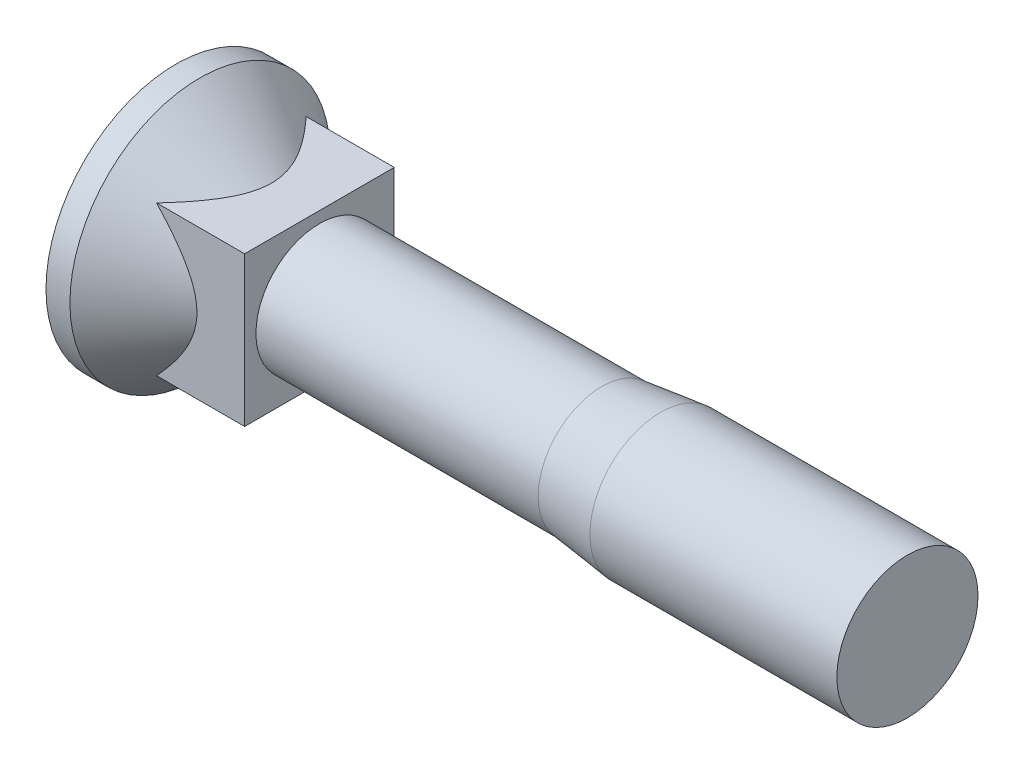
SolidWorks part; units mm, degrees
ref_plane "Front" through (0, 0, 0) normal (0, 0, 1) x (1, 0, 0)
ref_plane "Top" through (0, 0, 0) normal (0, 1, 0) x (1, 0, 0)
ref_plane "Right" through (0, 0, 0) normal (1, 0, 0) x (0, 0, -1)
other "Configuration Table"
ref_plane "Plane1" through (6.1, 0, 0) normal (1, 0, 0) x (0, 0, -1)
sketch "Sketch1" plane through (0, 0, 0) normal (0, 0, 1) x (1, 0, 0)
  line L0 (-5.3098, 0) -> (7.9048, 0) construction
  line L1 (0, 5.525) -> (0, 0)
  line L2 (0, 5.525) -> (1.0167, 5.525)
  line L3 (1.0167, 5.525) -> (7.5545, 0.5083)
  line L4 (7.5545, 0.5083) -> (7.5545, 0)
  line L5 (0, 0) -> (7.5545, 0)
revolve "BaseHead" add sketch "Sketch1" angle 360 about L0
sketch "Sketch2" plane through (6.1, 0, 0) normal (1, 0, 0) x (0, 0, -1)
  line L1 (3.18, -3.18) -> (3.18, 3.18)
  line L2 (3.18, 3.18) -> (-3.18, 3.18)
  line L3 (-3.18, 3.18) -> (-3.18, -3.18)
  line L4 (-3.18, -3.18) -> (3.18, -3.18)
  circle A0 centre (0, 0) radius 3.18 construction
extrude "Neck" add sketch "Sketch2" against normal up to surface (6.1 mm away)
sketch "Sketch3" plane through (6.1, 0, 0) normal (1, 0, 0) x (0, 0, -1)
  circle A0 centre (0, 0) radius 3
extrude "BaseBody" add sketch "Sketch3" along normal blind 25
sketch "Sketch4" plane through (0, 0, 0) normal (0, 1, 0) x (1, 0, 0)
  line L0 (-1.1729, 0) -> (32.1215, 0) construction
  line L2 (6.1, 2.7) -> (18.1, 2.7)
  line L3 (18.1, 2.7) -> (20.6, 3)
  line L4 (20.6, 3) -> (6.1, 3)
  line L5 (6.1, 3) -> (6.1, 2.7)
  line L6 (31.1, -3) -> (31.1, 3) construction
  line L7 (0, 5.525) -> (0, -5.525) construction
revolve "Cut-Extrude1" cut sketch "Sketch4" angle 360 about L0
sketch "Sketch5" plane through (0, 0, 0) normal (0, 0, 1) x (1, 0, 0)
  line L0 (30.8293, 3) -> (31.1, 2.531)
  line L1 (31.3708, 3.5415) -> (31.3708, 3)
  line L2 (31.1, -3) -> (31.1, 3) construction
  line L3 (31.1, 2.531) -> (31.3708, 3)
  line L4 (30.8293, 3.5415) -> (30.8293, 3)
  line L5 (31.1, 0) -> (0, 0) construction
  line L6 (30.8293, 3.5415) -> (31.3708, 3.5415)
  line L8 (31.1, 3) -> (20.6, 3) construction
revolve "Cut-Revolve10" [suppressed] cut sketch "Sketch5" angle 360 about L5
pattern_linear "LPattern10" [suppressed] count 16 spacing 0.6498 along (1, 0, 0)
equation "\"D4@Sketch2\" = \"Ss@Sketch2\" / 2"
equation "\"D3@Sketch2\" = \"D4@Sketch2\""
equation "\"D1@Sketch2\" = \"Ss@Sketch2\""
equation "\"D3@Sketch1\" = \"D2@Sketch1\" / 2"
equation "\"D2@Sketch1\" = \"k@Plane1\" / 6"
equation "\"D1@Sketch4\" = \"d@Sketch3\""
equation "\"D2@Sketch4\" =\"d@Sketch3\" * 0.9"
equation "\"D4@Sketch4\" = \"D1@ThreadCosmetic1\""
equation "\"D3@Sketch4\"=\"k@Plane1\""
equation "\"D2@Sketch5\" = (  \"d@Sketch3\" - \"D2@ThreadCosmetic1\" )  / 2"
equation "\"D3@LPattern10\" = \"D2@Sketch5\" * 1.2"
equation "\"D1@LPattern10\" = \"D1@ThreadCosmetic1\" / \"D3@LPattern10\""
